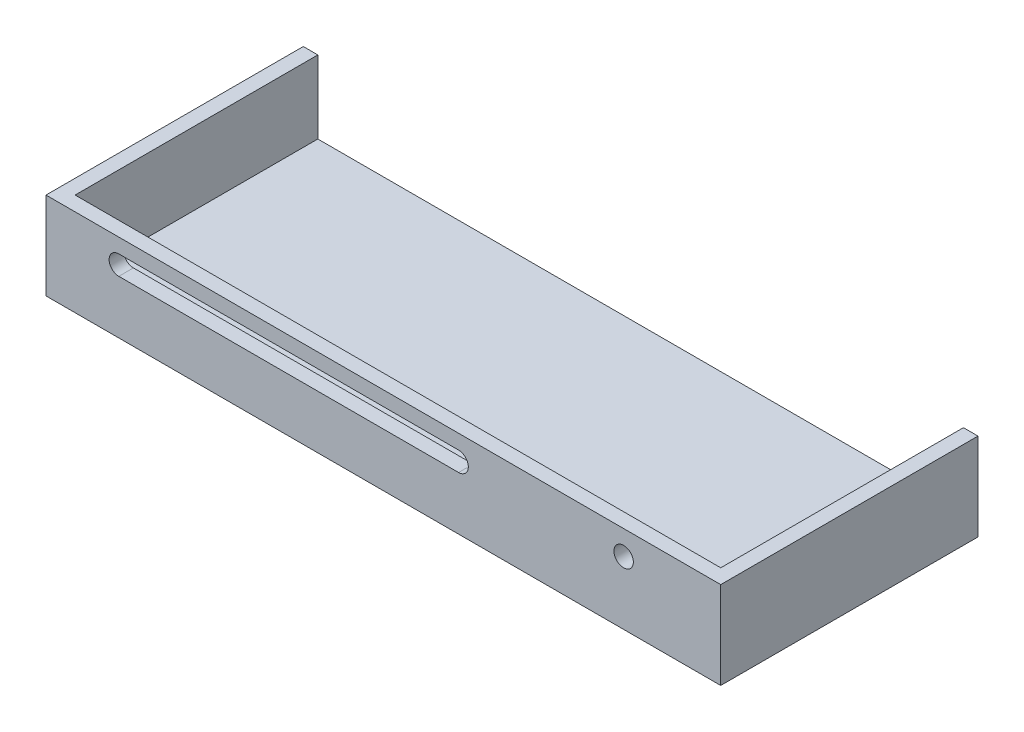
SolidWorks part; units mm, degrees
ref_plane "Front Plane" through (0, 0, 0) normal (0, 0, 1) x (1, 0, 0)
ref_plane "Top Plane" through (0, 0, 0) normal (0, 1, 0) x (1, 0, 0)
ref_plane "Right Plane" through (0, 0, 0) normal (1, 0, 0) x (0, 0, -1)
sketch "Sketch3" plane through (0, 0, 0) normal (1, 0, 0) x (0, 0, -1)
  line L0 (-34.8081, 35) -> (-34.8081, 10)
  line L2 (-37.8081, 0) -> (-37.8081, 35)
  line L3 (-37.8081, 35) -> (-34.8081, 35)
  line L4 (-19.8081, 0) -> (-19.8081, 35)
  line L5 (-34.8081, 10) -> (-22.8081, 10)
  line L6 (-22.8081, 10) -> (-22.8081, 35)
  line L7 (-22.8081, 35) -> (-19.8081, 35)
  line L18 (-29.8081, -3) -> (15.1919, -3)
  line L19 (15.1919, -3) -> (15.1919, 0)
  line L20 (15.1919, 0) -> (-19.8081, 0)
  line L21 (-37.8081, 0) -> (-37.8081, -3)
  line L22 (-29.8081, -3) -> (-37.8081, -3)
  dimension "D1" = 12
  dimension "D2" = 3
  dimension "D3" = 3
  dimension "D4" = 35
  dimension "D5" = 35
  dimension "D7" = 3
extrude "Boss-Extrude1" add sketch "Sketch3" along normal blind 139
sketch "Sketch5" plane through (0, 0, 19.8081) normal (0, 0, -1) x (-1, 0, 0)
  line L0 (-85, 30) -> (-15, 30) construction
  line L1 (-85, 32) -> (-15, 32)
  line L2 (-85, 28) -> (-15, 28)
  line L3 (-139, 0) -> (-139, 35) construction
  line L5 (0, 0) -> (0, 35) construction
  line L6 (-139, 35) -> (0, 35) construction
  circle A0 centre (-119, 30) radius 2
  arc A1 (-85, 32) -> (-85, 28) centre (-85, 30) ccw
  arc A2 (-15, 28) -> (-15, 32) centre (-15, 30) ccw
  point P2 (-50, 30)
  dimension "D1" = 4
  dimension "D2" = 4
  dimension "D3" = 20
  dimension "D4" = 5
  dimension "D5" = 15
  dimension "D6" = 70
extrude "Cut-Extrude1" cut sketch "Sketch5" against normal through all
sketch "Sketch6" plane through (0, 0, 0) normal (0, 1, 0) x (1, 0, 0)
  line L0 (139, 15.1919) -> (0, 15.1919) construction
  line L1 (0, -19.8081) -> (3, -19.8081)
  line L2 (0, -19.8081) -> (0, 15.1919)
  line L3 (0, 15.1919) -> (3, 15.1919)
  line L4 (3, -19.8081) -> (3, 15.1919)
  line L6 (139, -19.8081) -> (136, -19.8081)
  line L7 (139, -19.8081) -> (139, 15.1919)
  line L8 (139, 15.1919) -> (136, 15.1919)
  line L9 (136, -19.8081) -> (136, 15.1919)
  dimension "D1" = 3
extrude "Boss-Extrude2" add sketch "Sketch6" along normal up to surface (35 mm away)
sketch "Sketch7" plane through (0, 0, 19.8081) normal (0, 0, -1) x (-1, 0, 0)
  line L1 (-3, 0) -> (-136, 0)
  line L2 (-3, 0) -> (-3, 35)
  line L3 (-3, 35) -> (-136, 35)
  line L4 (-136, 0) -> (-136, 35)
extrude "Boss-Extrude3" add sketch "Sketch7" along normal blind 5
sketch "Sketch8" plane through (0, 0, 14.8081) normal (0, 0, -1) x (-1, 0, 0)
  line L1 (-136, 0) -> (-3, 0)
  line L2 (-136, 0) -> (-136, 35)
  line L3 (-136, 35) -> (-3, 35)
  line L4 (-3, 0) -> (-3, 35)
extrude "Cut-Extrude2" cut sketch "Sketch8" against normal up to surface (20 mm away)
sketch "Sketch9" plane through (0, 10, 0) normal (0, 1, 0) x (1, 0, 0)
  line L1 (139, -34.8081) -> (136, -34.8081)
  line L2 (139, -34.8081) -> (139, -22.8081)
  line L3 (139, -22.8081) -> (136, -22.8081)
  line L4 (136, -34.8081) -> (136, -22.8081)
  line L5 (0, -34.8081) -> (3, -34.8081)
  line L6 (0, -34.8081) -> (0, -22.8081)
  line L7 (0, -22.8081) -> (3, -22.8081)
  line L8 (3, -34.8081) -> (3, -22.8081)
extrude "Boss-Extrude4" add sketch "Sketch9" along normal up to surface (25 mm away)
sketch "Sketch10" plane through (0, 0, 0) normal (0, 1, 0) x (1, 0, 0)
  line L1 (3, -34.8081) -> (136, -34.8081)
  line L2 (3, -34.8081) -> (3, 15.1919)
  line L3 (3, 15.1919) -> (136, 15.1919)
  line L4 (136, -34.8081) -> (136, 15.1919)
extrude "Boss-Extrude5" add sketch "Sketch10" along normal blind 20
sketch "Sketch11" plane through (0, -3, 0) normal (0, -1, 0) x (1, 0, 0)
  line L1 (0, 37.8081) -> (139, 37.8081)
  line L2 (0, 37.8081) -> (0, -15.1919)
  line L3 (0, -15.1919) -> (139, -15.1919)
  line L4 (139, 37.8081) -> (139, -15.1919)
extrude "Cut-Extrude3" cut sketch "Sketch11" against normal blind 20
